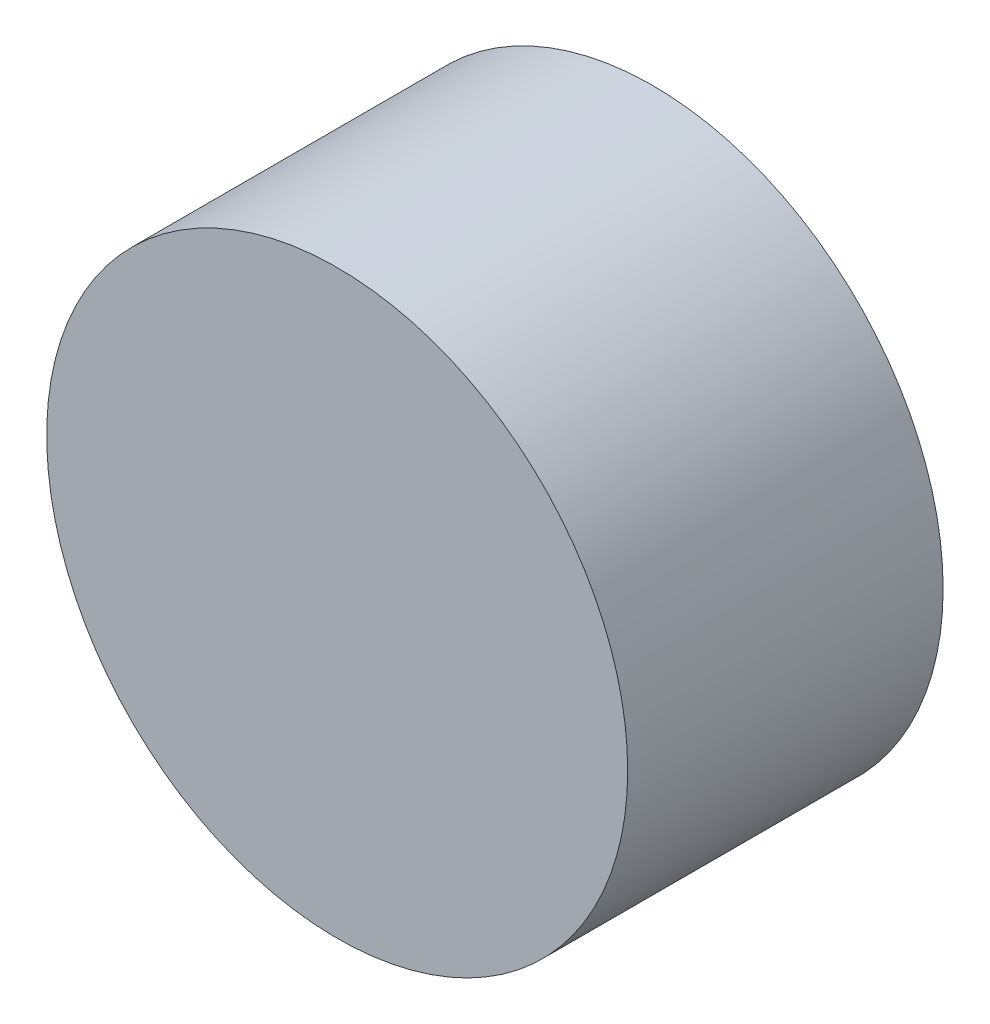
SolidWorks part; units mm, degrees
ref_plane "Front Plane" through (0, 0, 0) normal (0, 0, 1) x (1, 0, 0)
ref_plane "Top Plane" through (0, 0, 0) normal (0, 1, 0) x (1, 0, 0)
ref_plane "Right Plane" through (0, 0, 0) normal (1, 0, 0) x (0, 0, -1)
ref_plane "Plane1" through (0, 0, -1.5) normal (0, 0, 1) x (1, 0, 0)
sketch "Sketch1" plane through (0, 0, 0) normal (0, 0, 1) x (1, 0, 0)
  circle A0 centre (0, 0) radius 17
  dimension "D1" = 34
extrude "Boss-Extrude1" add sketch "Sketch1" against normal blind 1
sketch "Sketch4" plane through (0, 0, 0) normal (0, 0, 1) x (1, 0, 0)
  circle A0 centre (0, 0) radius 1.2
  dimension "D1" = 2.4
extrude "Cut-Extrude1" cut sketch "Sketch4" against normal through all
sketch "Sketch6" plane through (0, 0, 0) normal (0, 0, 1) x (1, 0, 0)
  circle A0 centre (0, 0) radius 1
  circle A2 centre (0, 0) radius 2
  dimension "D1" = 2
  dimension "D2" = 4
extrude "Boss-Extrude3" add sketch "Sketch6" along normal blind 6
sketch "Sketch7" plane through (0, 0, 0) normal (0, 0, 1) x (1, 0, 0)
  line L0 (0, 0) -> (5.0585, 6.1977) construction
  line L2 (5.8113, 6.8559) -> (5.0585, 6.1977)
  line L3 (13.1333, -9.7777) -> (14.0951, -9.5041)
  circle A3 centre (0, 0) radius 17 construction
  spline S0 degree 3 poles (5.0585, 6.1977) (10.3865, 0.1026) (10.5506, -0.7003) (13.1333, -9.7777) knots 0 0 0 0 0.864172 0.864172 0.864172 0.864172
  spline S1 degree 1 poles (5.8113, 6.8559) (14.0951, -9.5041) knots 0 0 1 1 construction
  spline S2 degree 3 poles (5.8113, 6.8559) (5.974, 6.6698) (6.3051, 6.2898) (6.9136, 5.5853) (7.6134, 4.7605) (8.3564, 3.852) (9.2372, 2.7164) (10.1576, 1.3887) (11.0472, -0.2089) (11.7915, -1.9382) (12.3632, -3.6012) (12.8397, -5.1455) (13.218, -6.4307) (13.5617, -7.6295) (13.8568, -8.6659) (14.0167, -9.2284) (14.0951, -9.5041) knots 0 0 0 0 0.027005 0.054011 0.108021 0.162032 0.216043 0.324064 0.432086 0.540107 0.648129 0.70214 0.75615 0.810161 0.837166 0.864172 0.864172 0.864172 0.864172
  dimension "D1" = 8
  dimension "D2" = 1
extrude "Boss-Extrude5" add sketch "Sketch7" along normal blind 17
fillet "Fillet1" radius 1 1 edges at (5.8113, 6.8559, 8.5)
fillet "Fillet2" radius 1 1 edges at (14.0951, -9.5041, 8.5)
pattern_circular "CirPattern3" count 6 over 360 about axis through (0, 0, 6) along (0, 0, 1) of "Fillet1", "Boss-Extrude5", "Fillet2"
fillet "Fillet4" radius 1 2 edges at (2, 0, 0) (2, 0, 6)
sketch "Sketch11" plane through (0, 0, -1.5) normal (0, 0, 1) x (1, 0, 0)
  circle A0 centre (0, 0) radius 17.5
  dimension "D1" = 35
extrude "Boss-Extrude10" add sketch "Sketch11" along normal blind 19 separate body contours A0
